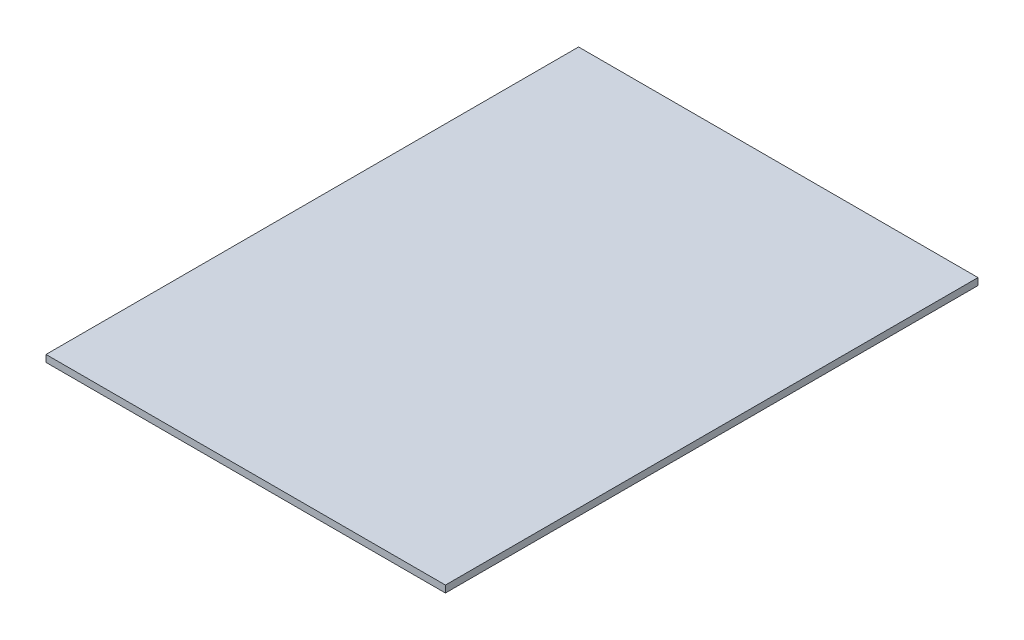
SolidWorks part; units mm, degrees
ref_plane "Front Plane" through (0, 0, 0) normal (0, 0, 1) x (1, 0, 0)
ref_plane "Top Plane" through (0, 0, 0) normal (0, 1, 0) x (1, 0, 0)
ref_plane "Right Plane" through (0, 0, 0) normal (1, 0, 0) x (0, 0, -1)
sketch "Sketch1" plane through (0, 0, 0) normal (0, 1, 0) x (1, 0, 0)
  line L1 (-342.9, -457.2) -> (342.9, -457.2)
  line L2 (-342.9, -457.2) -> (-342.9, 457.2)
  line L3 (-342.9, 457.2) -> (342.9, 457.2)
  line L4 (342.9, -457.2) -> (342.9, 457.2)
  line L5 (-342.9, -457.2) -> (342.9, 457.2) construction
  line L6 (-342.9, 457.2) -> (342.9, -457.2) construction
  point P0 (0, 0)
  dimension "D1" = 685.8
  dimension "D2" = 914.4
extrude "Boss-Extrude1" add sketch "Sketch1" along normal blind 11.9062
